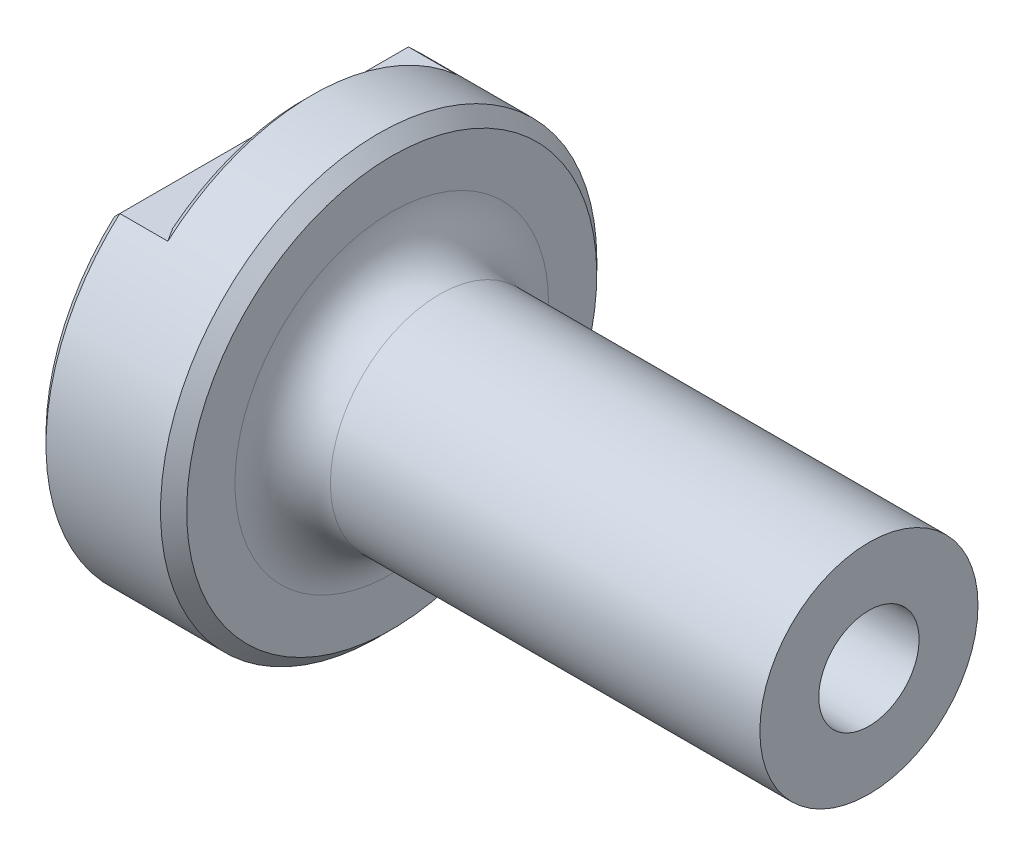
SolidWorks part; units mm, degrees
ref_plane "Front Plane" through (0, 0, 0) normal (0, 0, 1) x (1, 0, 0)
ref_plane "Top Plane" through (0, 0, 0) normal (0, 1, 0) x (1, 0, 0)
ref_plane "Right Plane" through (0, 0, 0) normal (1, 0, 0) x (0, 0, -1)
sketch "Sketch1" plane through (0, 0, 0) normal (1, 0, 0) x (0, 0, -1)
  circle A0 centre (0, 0) radius 25.4
  dimension "Rod Dia" = 50.8
extrude "Boss-Extrude1" add sketch "Sketch1" along normal mid plane 71.4375 contours A0
sketch "Sketch3" plane through (-35.7188, 0, 0) normal (-1, 0, 0) x (0, 0, 1)
  line L1 (-25.4, 25.4) -> (25.4, 25.4)
  line L2 (-25.4, 25.4) -> (-25.4, 19.05)
  line L3 (-25.4, 19.05) -> (25.4, 19.05)
  line L4 (25.4, 25.4) -> (25.4, 19.05)
  line L5 (-25.4, 25.4) -> (25.4, 19.05) construction
  line L6 (-25.4, 19.05) -> (25.4, 25.4) construction
  circle A0 centre (0, 0) radius 25.4 construction
  point P0 (0, 22.225)
  dimension "D1" = 19.05
extrude "Cut-Extrude1" cut sketch "Sketch3" against normal blind 5.588
sketch "Sketch5" plane through (0, 0, 0) normal (0, 0, 1) x (1, 0, 0)
  line L0 (35.7187, 0) -> (-35.7188, 0) construction
  line L1 (35.7188, -25.4) -> (35.7188, 25.4) construction
  line L2 (-35.7188, 19.05) -> (-35.7188, -25.4) construction
  line L3 (-19.8438, -12.7) -> (35.7188, -12.7)
  line L4 (35.7188, -12.7) -> (35.7188, -25.4)
  line L5 (35.7188, -25.4) -> (-19.8438, -25.4)
  line L6 (-35.7188, -25.4) -> (35.7188, -25.4) construction
  line L7 (-19.8438, -25.4) -> (-19.8438, -12.7)
  dimension "B" = 15.875
  dimension "D" = 25.4
revolve "Cut-Revolve1" cut sketch "Sketch5" angle 360 about L0
sketch "Sketch6" plane through (0, 0, 0) normal (0, 0, 1) x (1, 0, 0)
  line L0 (35.7188, 0) -> (-35.7188, 0) construction
  line L1 (35.7188, -12.7) -> (35.7188, 12.7) construction
  line L2 (-35.7188, 19.05) -> (-35.7188, -25.4) construction
  line L3 (-31.096, 0) -> (-35.7188, 0)
  line L5 (-35.7188, 9.8005) -> (-35.7188, 0)
  arc A0 (-35.7188, 9.8005) -> (-31.096, 0) centre (-43.7959, 0) cw
  dimension "D1" = 12.7
  dimension "D2" = 4.6228
revolve "Cut-Revolve2" cut sketch "Sketch6" angle 360 about L0
sketch "Sketch7" plane through (0, 0, 0) normal (0, 0, 1) x (1, 0, 0)
  line L0 (-31.8699, 4.3656) -> (35.7187, 5.8404)
  line L2 (35.7188, -12.7) -> (35.7188, 12.7) construction
  line L3 (-31.8699, 0) -> (35.7188, 0)
  line L4 (35.7188, 0) -> (-35.7188, 0) construction
  line L5 (-35.7188, 19.05) -> (-35.7188, -25.4) construction
  line L6 (35.7187, 5.8404) -> (35.7188, 0)
  line L7 (-31.8699, 4.3656) -> (-31.8699, 0)
  line L8 (35.7188, 0) -> (41.1743, 0.1051)
  arc A1 (-35.7188, -9.8005) -> (-35.7188, 9.8005) centre (-43.7959, 0) ccw construction
  dimension "D1" = 1.25
  dimension "D2" = 8.7312
revolve "Cut-Revolve3" cut sketch "Sketch7" angle 360 about L4
fillet "Fillet1" radius 5.5562 1 edges at (-19.8438, 12.7, 0)
chamfer "Chamfer1" distance 1.524 angle 45 1 edges at (-19.8438, 25.4, 0)
chamfer "Chamfer2" distance 1.016 angle 45 3 edges at (-30.1308, 25.4, 0) (-35.7188, -25.4, 0) (-35.7188, 19.05, 0)
